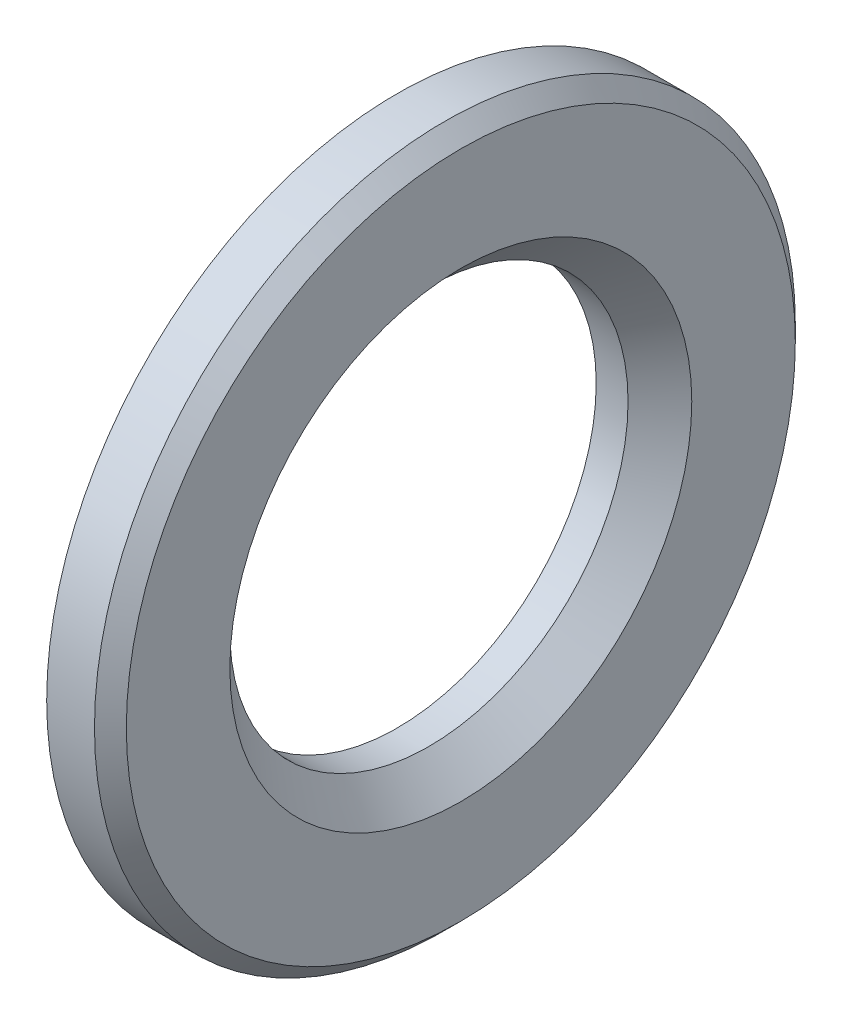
SolidWorks part; units mm, degrees
ref_plane "Plane1" through (0, 0, 0) normal (0, 0, 1) x (1, 0, 0)
ref_plane "Plane2" through (0, 0, 0) normal (0, 1, 0) x (1, 0, 0)
ref_plane "Plane3" through (0, 0, 0) normal (1, 0, 0) x (0, 0, -1)
other "Configuration Table"
sketch "Sketch1" plane through (0, 0, 0) normal (1, 0, 0) x (0, 0, -1)
  circle A0 centre (0, 0) radius 12.5
  circle A1 centre (0, 0) radius 22
  dimension "InsideDia" = 25
  dimension "OutsideDia" = 44
extrude "Base-Extrude" add sketch "Sketch1" along normal blind 4
chamfer "IDchamfer" distance 2 angle 45 1 edges at (4, 0, -12.5)
chamfer "ODchamfer" distance 1 angle 45 1 edges at (4, 0, -22)
